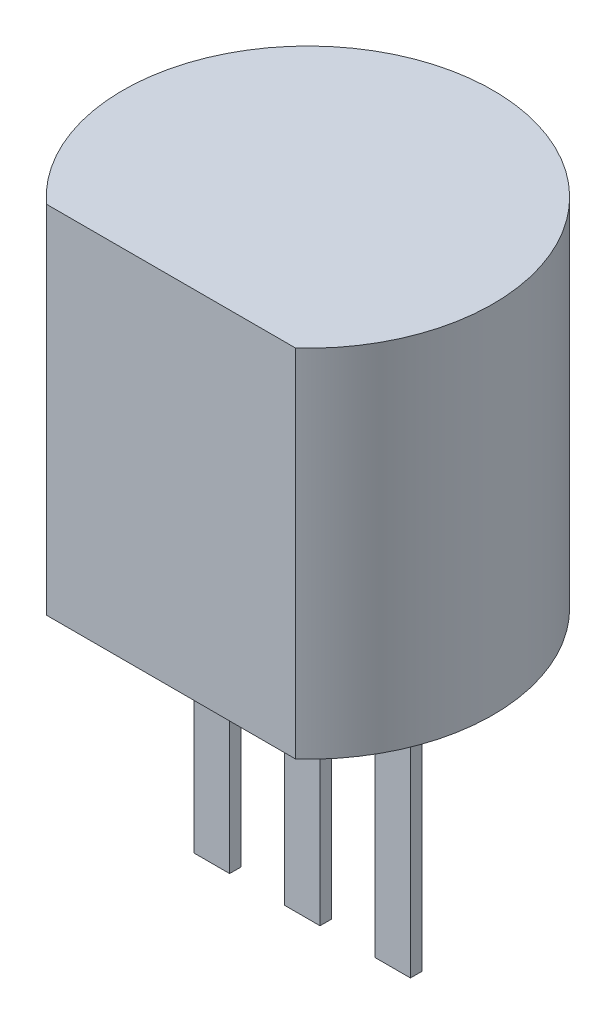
SolidWorks part; units mm, degrees
ref_plane "Front" through (0, 0, 0) normal (0, 0, 1) x (1, 0, 0)
ref_plane "Top" through (0, 0, 0) normal (0, 1, 0) x (1, 0, 0)
ref_plane "Right" through (0, 0, 0) normal (1, 0, 0) x (0, 0, -1)
sketch "Эскиз1" plane through (0, 0, 0) normal (0, 1, 0) x (1, 0, 0)
  line L0 (-1.75, -1.9229) -> (1.75, -1.9229)
  line L1 (0, 0) -> (0, -1.9229) construction
  arc A0 (1.75, -1.9229) -> (-1.75, -1.9229) centre (0, 0) ccw
  dimension "D1" = 5.2
  dimension "D2" = 3.5
extrude "Вытянуть1" add sketch "Эскиз1" along normal blind 5 from offset 1.5
sketch "Эскиз2" plane through (0, 1.5, 0) normal (0, -1, 0) x (1, 0, 0)
  line L0 (-0.25, -0.08) -> (0.25, -0.08)
  line L1 (-1.52, -0.08) -> (-1.02, -0.08)
  line L2 (-1.52, -0.08) -> (-1.52, 0.08)
  line L3 (-1.52, 0.08) -> (-1.02, 0.08)
  line L4 (-1.02, -0.08) -> (-1.02, 0.08)
  line L23 (-1.52, -0.08) -> (-1.02, 0.08) construction
  line L24 (-1.52, 0.08) -> (-1.02, -0.08) construction
  line L25 (-0.25, -0.08) -> (-0.25, 0.08)
  line L26 (-0.25, 0.08) -> (0.25, 0.08)
  line L27 (0.25, -0.08) -> (0.25, 0.08)
  line L28 (-0.25, -0.08) -> (0.25, 0.08) construction
  line L29 (-0.25, 0.08) -> (0.25, -0.08) construction
  line L30 (1.02, -0.08) -> (1.52, -0.08)
  line L31 (1.02, -0.08) -> (1.02, 0.08)
  line L32 (1.02, 0.08) -> (1.52, 0.08)
  line L33 (1.52, -0.08) -> (1.52, 0.08)
  line L34 (1.02, -0.08) -> (1.52, 0.08) construction
  line L35 (1.02, 0.08) -> (1.52, -0.08) construction
  point P0 (-1.27, 0)
  point P11 (0, 0)
  point P27 (1.27, 0)
  dimension "D1" = 0.5
  dimension "D2" = 0.16
  dimension "D6" = 1.27
extrude "Вытянуть2" add sketch "Эскиз2" along normal blind 3.7
